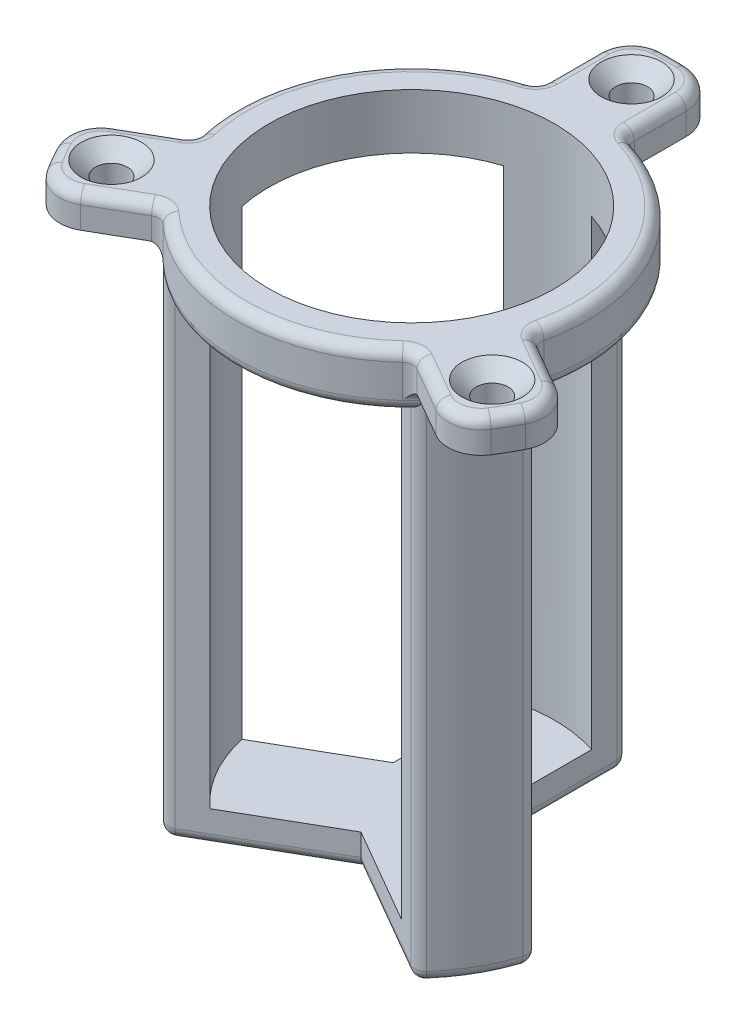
SolidWorks part; units mm, degrees
ref_plane "Plano frontal" through (0, 0, 0) normal (0, 0, 1) x (1, 0, 0)
ref_plane "Plano superior" through (0, 0, 0) normal (0, 1, 0) x (1, 0, 0)
ref_plane "Plano direito" through (0, 0, 0) normal (1, 0, 0) x (0, 0, -1)
sketch "Esboço1" plane through (0, 0, 0) normal (0, 1, 0) x (1, 0, 0)
  line L0 (0, 0) -> (0, 16) construction
  line L1 (0, 0) -> (13.8564, -8) construction
  line L2 (0, 0) -> (-13.8564, -8) construction
  line L3 (-11.4164, -11.2101) -> (0, -4.6188)
  line L4 (0, -4.6188) -> (11.4164, -11.2101)
  line L5 (-15.4164, -4.2819) -> (-4, 2.3094)
  line L6 (-4, 2.3094) -> (-4, 15.4919)
  line L8 (4, 2.3094) -> (15.4164, -4.2819)
  line L9 (4, 15.4919) -> (4, 2.3094)
  arc A0 (-4, 15.4919) -> (4, 15.4919) centre (0, 0) ccw construction
  arc A3 (11.4164, -11.2101) -> (15.4164, -4.2819) centre (0, 0) ccw
  arc A5 (12.7121, -2.7206) -> (4, 12.3693) centre (0, 0) ccw construction
  arc A7 (-11.4164, -11.2101) -> (-15.4164, -4.2819) centre (0, 0) cw
  arc A8 (-4, 12.3693) -> (-12.7121, -2.7206) centre (0, 0) ccw construction
  arc A9 (-8.7121, -9.6488) -> (8.7121, -9.6488) centre (0, 0) ccw construction
  arc A10 (-4, 15.4919) -> (4, 15.4919) centre (0, 0) cw
  dimension "D1" = 32
  dimension "D2" = 26
  dimension "D6" = 8
  dimension "D3" = 8
  dimension "D4" = 120
  dimension "D5" = 120
  dimension "D7" = 8
extrude "Ressalto-extrusão1" add sketch "Esboço1" along normal blind 3
sketch "Esboço2" plane through (0, 3, 0) normal (0, 1, 0) x (1, 0, 0)
  line L0 (0, -4.6188) -> (11.4164, -11.2101) construction
  line L1 (-4, 15.4919) -> (-4, 2.3094) construction
  line L2 (4, 2.3094) -> (4, 15.4919) construction
  line L3 (15.4164, -4.2819) -> (4, 2.3094) construction
  line L4 (-11.4164, -11.2101) -> (0, -4.6188) construction
  line L5 (-4, 2.3094) -> (-15.4164, -4.2819) construction
  line L6 (-4, 15.4919) -> (-4, 12.3693)
  line L7 (4, 15.4919) -> (4, 12.3693)
  line L8 (12.7121, -2.7206) -> (15.4164, -4.2819)
  line L9 (11.4164, -11.2101) -> (8.7121, -9.6488)
  line L10 (-8.7121, -9.6488) -> (-11.4164, -11.2101)
  line L11 (-15.4164, -4.2819) -> (-12.7121, -2.7206)
  arc A0 (-11.4164, -11.2101) -> (-15.4164, -4.2819) centre (0, 0) cw
  arc A1 (-15.4164, -4.2819) -> (-11.4164, -11.2101) centre (0, 0) ccw construction
  arc A2 (15.4164, -4.2819) -> (11.4164, -11.2101) centre (0, 0) cw
  arc A3 (-4, 12.3693) -> (4, 12.3693) centre (0, 0) cw
  arc A4 (-4, 15.4919) -> (4, 15.4919) centre (0, 0) cw
  arc A5 (4, 15.4919) -> (-4, 15.4919) centre (0, 0) ccw construction
  arc A6 (12.7121, -2.7206) -> (8.7121, -9.6488) centre (0, 0) cw
  arc A7 (-8.7121, -9.6488) -> (-12.7121, -2.7206) centre (0, 0) cw
  dimension "D1" = 13
extrude "Ressalto-extrusão2" add sketch "Esboço2" along normal blind 42
sketch "Esboço3" plane through (0, 45, 0) normal (0, 1, 0) x (1, 0, 0)
  circle A0 centre (0, 0) radius 16
  circle A1 centre (0, 0) radius 13
  dimension "D1" = 32
  dimension "D2" = 26
extrude "Ressalto-extrusão3" add sketch "Esboço3" along normal blind 5
sketch "Esboço5" plane through (0, 50, 0) normal (0, 1, 0) x (1, 0, 0)
  line L0 (-8.7121, -9.6488) -> (-16.1659, -13.9522)
  line L1 (-12.7121, -2.7206) -> (-20.1659, -7.024)
  line L2 (-4, 2.3094) -> (-12.7121, -2.7206) construction
  line L3 (8.7121, -9.6488) -> (16.1659, -13.9522)
  line L4 (12.7121, -2.7206) -> (20.1659, -7.024)
  line L5 (4, 12.3693) -> (4, 20.9762)
  line L6 (-4, 12.3693) -> (-4, 20.9762)
  line L7 (-8.7121, -9.6488) -> (0, -4.6188) construction
  line L8 (0, -4.6188) -> (8.7121, -9.6488) construction
  line L9 (12.7121, -2.7206) -> (4, 2.3094) construction
  arc A0 (-21.3325, -10.9966) -> (-20.1896, -12.9761) centre (0, 0) ccw
  circle A1 centre (0, 0) radius 13 construction
  arc A2 (4, 12.3693) -> (-4, 12.3693) centre (0, 0) ccw
  arc A3 (-12.7121, -2.7206) -> (-8.7121, -9.6488) centre (0, 0) ccw
  arc A4 (1.1429, 23.9728) -> (-1.1429, 23.9728) centre (0, 0) ccw
  arc A5 (8.7121, -9.6488) -> (12.7121, -2.7206) centre (0, 0) ccw
  arc A6 (20.1896, -12.9761) -> (21.3325, -10.9966) centre (0, 0) ccw
  arc A7 (-4, 20.9762) -> (-1.1429, 23.9728) centre (-1, 20.9762) cw
  arc A8 (4, 20.9762) -> (1.1429, 23.9728) centre (1, 20.9762) ccw
  arc A9 (20.1659, -7.024) -> (21.3325, -10.9966) centre (18.6659, -9.6221) cw
  arc A10 (16.1659, -13.9522) -> (20.1896, -12.9761) centre (17.6659, -11.3541) ccw
  arc A11 (-16.1659, -13.9522) -> (-20.1896, -12.9761) centre (-17.6659, -11.3541) cw
  arc A12 (-20.1659, -7.024) -> (-21.3325, -10.9966) centre (-18.6659, -9.6221) ccw
  point P35 (4, 23.6643)
  point P40 (18.4939, -15.2963)
  dimension "D1" = 48
  dimension "D2" = 3
extrude "Ressalto-extrusão4" add sketch "Esboço5" against normal blind 3
fillet "Filete3" radius 1 45 edges at (0, 50, -24) (-20.7846, 50, 12) (20.7846, 50, 12) (3.1712, 50, -23.0464) (-3.1712, 50, -23.0464) (-21.5444, 50, 8.7768) (-18.3731, 50, 14.2696) (18.3731, 50, 14.2696) (21.5444, 50, 8.7768) (4, 50, -18.2341) (-4, 50, -18.2341) (-17.7912, 50, 5.6529) (-13.7912, 50, 12.5811) (13.7912, 50, 12.5811) (17.7912, 50, 5.6529) (-4, 0, -8.9007) (-9.7082, 0, 0.9862) (-5.7082, 0, 7.9144) (5.7082, 0, 7.9144) (9.7082, 0, 0.9862) (4, 0, -8.9007) (11.4164, 22.5, 11.2101) (0, 45, 16) (-11.4164, 22.5, 11.2101) (-13.8564, 0, 8) (-15.4164, 22.5, 4.2819) (-13.8564, 45, -8) (-4, 22.5, -15.4919) (0, 0, -16) (4, 22.5, -15.4919) (13.8564, 45, -8) (15.4164, 22.5, 4.2819) (13.8564, 0, 8) (4, 48.5, -15.4919) (0, 47, -16) (-4, 48.5, -15.4919) (-13.8564, 50, -8) (-15.4164, 48.5, 4.2819) (-13.8564, 47, 8) (-11.4164, 48.5, 11.2101) (0, 50, 16) (11.4164, 48.5, 11.2101) (13.8564, 47, 8) (15.4164, 48.5, 4.2819) (13.8564, 50, -8)
sketch "Esboço6" plane through (0, 50, 0) normal (0, 1, 0) x (1, 0, 0)
  line L0 (0, 0) -> (0, 20) construction
  line L1 (0, 0) -> (17.3205, -10) construction
  line L2 (0, 0) -> (-17.3205, -10) construction
  point P4 (0, 20)
  dimension "D1" = 20
  dimension "D2" = 3
hole_wizard "Escareado para parafuso com cabeça escareada chata de M2.51" positions "3DSketch2" profile "Esboço8" countersink size "M2.5" standard "ISO"
sketch3d "3DSketch2"
  point P0 (0, 50, -20)
  point P3 (17.3205, 50, 10)
  point P6 (-17.3205, 50, 10)
sketch "Esboço8" plane through (0, 50, -20) normal (1, 0, 0) x (0, 0, 1)
  line L0 (0, 0) -> (0, 3)
  line L1 (0, 3) -> (1.45, 3)
  line L2 (1.45, 3) -> (1.45, 1.3)
  line L3 (1.45, 1.3) -> (2.75, 0)
  line L5 (2.75, 0) -> (0, 0)
  line L6 (-1.45, 1.3) -> (-2.75, 0) construction
  line L11 (0, -6.35) -> (0, 107.95) construction
  dimension "Thru Hole Dia." = 2.9
  dimension "Thru Hole Depth" = 3
  dimension "Near C'Sink Dia." = 5.5
  dimension "Near C'Sink Angle" = 90
